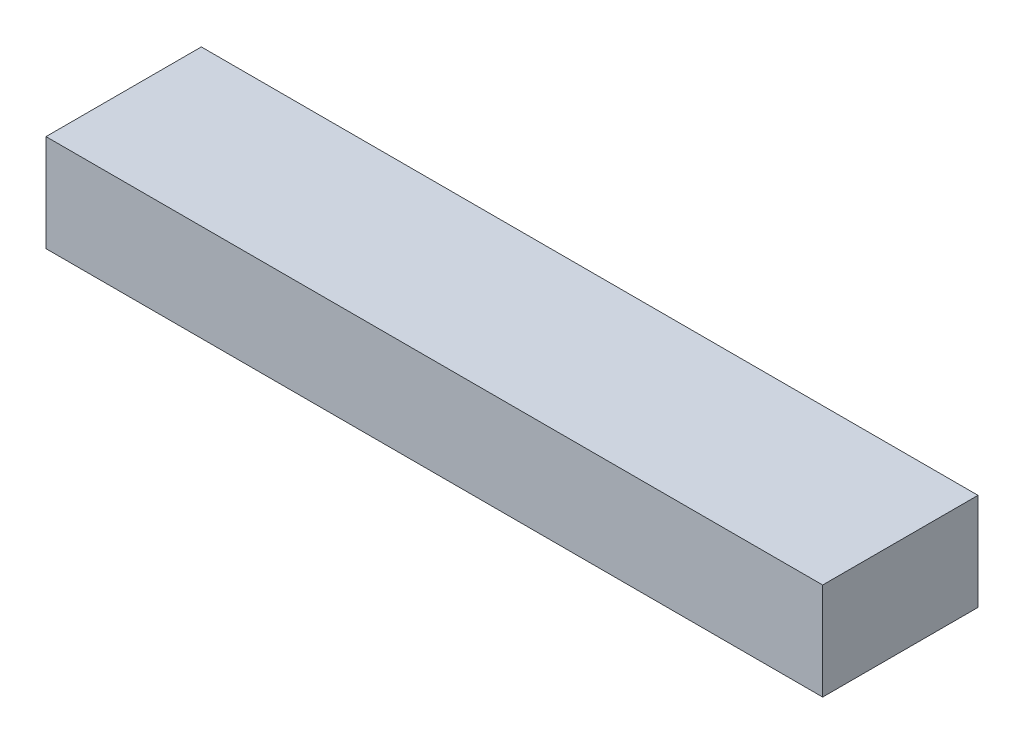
SolidWorks part; units mm, degrees
ref_plane "Plan de face" through (0, 0, 0) normal (0, 0, 1) x (1, 0, 0)
ref_plane "Plan de dessus" through (0, 0, 0) normal (0, 1, 0) x (1, 0, 0)
ref_plane "Plan de droite" through (0, 0, 0) normal (1, 0, 0) x (0, 0, -1)
sketch "Esquisse1" plane through (0, 0, 0) normal (0, 0, 1) x (1, 0, 0)
  line L1 (0, 0) -> (40, 0)
  line L2 (0, 0) -> (0, 5)
  line L3 (0, 5) -> (40, 5)
  line L4 (40, 0) -> (40, 5)
  dimension "D1" = 40
  dimension "D2" = 5
extrude "Extrusion1" add sketch "Esquisse1" along normal blind 8
